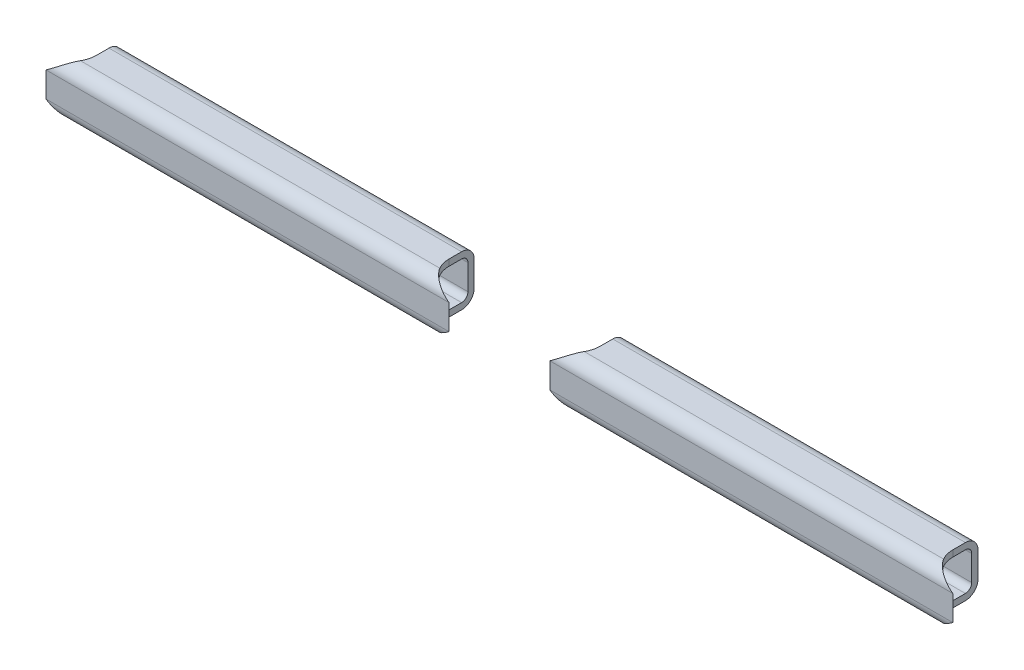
SolidWorks part; units mm, degrees
ref_plane "Front Plane" through (0, 0, 0) normal (0, 0, 1) x (1, 0, 0)
ref_plane "Top Plane" through (0, 0, 0) normal (0, 1, 0) x (1, 0, 0)
ref_plane "Right Plane" through (0, 0, 0) normal (1, 0, 0) x (0, 0, -1)
sketch "Sketch1" plane through (0, 0, 0) normal (0, 0, 1) x (1, 0, 0)
  line L0 (533.4, -897.7054) -> (127, -897.7054)
  line L1 (533.4, -2092.3155) -> (533.4, -215.6205) construction
  line L2 (628.65, -897.7054) -> (-482.6, -897.7054) construction
  line L3 (127, -2092.3155) -> (127, -215.6205) construction
  line L4 (25.4, -897.7054) -> (-381, -897.7054)
  line L5 (25.4, -2092.3155) -> (25.4, -215.6205) construction
  line L6 (-381, -2092.3155) -> (-381, -215.6205) construction
other "Structural Member1"
ref_plane "Plane1" through (533.4, -897.7054, 0) normal (-1, 0, 0) x (0, -1, 0)
sketch "Sketch11" plane through (533.4, -897.7054, 0) normal (-1, 0, 0) x (0, -1, 0)
  line L0 (-12.7, -19.05) -> (12.7, -19.05)
  line L1 (-19.05, -12.7) -> (-19.05, 12.7)
  line L2 (12.7, 19.05) -> (-12.7, 19.05)
  line L3 (19.05, 12.7) -> (19.05, -12.7)
  line L4 (-12.7, -25.4) -> (12.7, -25.4)
  line L5 (-25.4, -12.7) -> (-25.4, 12.7)
  line L6 (12.7, 25.4) -> (-12.7, 25.4)
  line L7 (25.4, 12.7) -> (25.4, -12.7)
  line L8 (-25.4, 0) -> (-19.05, 0) construction
  line L9 (-19.05, 0) -> (19.05, 0) construction
  line L10 (19.05, 0) -> (25.4, 0) construction
  line L11 (0, 25.4) -> (0, 19.05) construction
  line L12 (0, 19.05) -> (0, -19.05) construction
  line L13 (0, -19.05) -> (0, -25.4) construction
  arc A0 (25.4, 12.7) -> (12.7, 25.4) centre (12.7, 12.7) ccw
  arc A1 (12.7, -25.4) -> (25.4, -12.7) centre (12.7, -12.7) ccw
  arc A2 (-25.4, -12.7) -> (-12.7, -25.4) centre (-12.7, -12.7) ccw
  arc A3 (-12.7, 25.4) -> (-25.4, 12.7) centre (-12.7, 12.7) ccw
  arc A4 (-12.7, 19.05) -> (-19.05, 12.7) centre (-12.7, 12.7) ccw
  arc A5 (19.05, 12.7) -> (12.7, 19.05) centre (12.7, 12.7) ccw
  arc A6 (12.7, -19.05) -> (19.05, -12.7) centre (12.7, -12.7) ccw
  arc A7 (-19.05, -12.7) -> (-12.7, -19.05) centre (-12.7, -12.7) ccw
  point P6 (-25.4, -25.4)
  point P33 (-25.4, 25.4)
  point P35 (25.4, 25.4)
  point P36 (25.4, -25.4)
  point P37 (0, 0)
  dimension "D1" = 12.7
  dimension "Thickness" = 6.35
  dimension "V_leg" = 50.8
  dimension "H_leg" = 50.8
other "Trim/Extend1"
other "Trim/Extend2"
